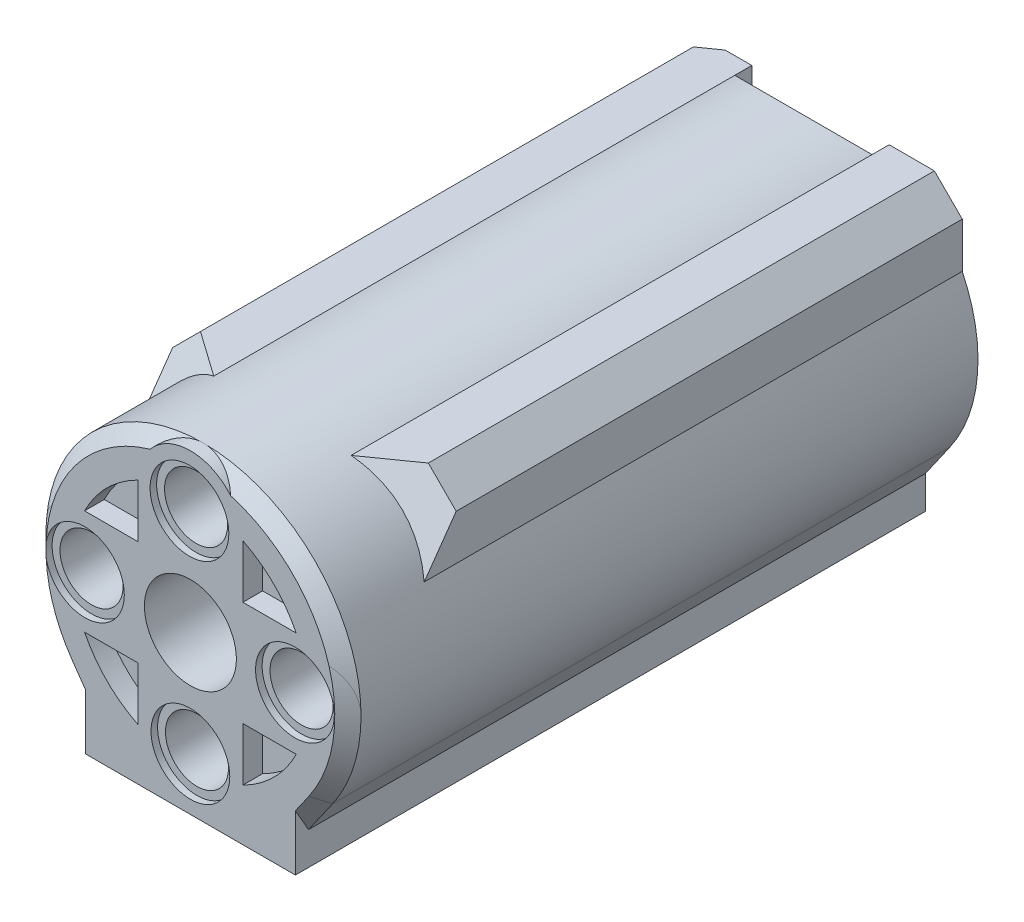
SolidWorks part; units mm, degrees
ref_plane "정면" through (0, 0, 0) normal (0, 0, 1) x (1, 0, 0)
ref_plane "윗면" through (0, 0, 0) normal (0, 1, 0) x (1, 0, 0)
ref_plane "우측면" through (0, 0, 0) normal (1, 0, 0) x (0, 0, -1)
imported_body "불러온 피처3"
sketch "스케치1" plane through (0, 0, -22.7) normal (0, 0, -1) x (-1, 0, 0)
  line L0 (10.8, 10.8) -> (10.8, 5.2307)
  line L1 (9.8345, -6.8762) -> (8, -9.5)
  line L2 (8, -9.5) -> (-8, -9.5)
  line L3 (-8, -9.5) -> (-9.8345, -6.8762)
  line L4 (-10.8, 5.2307) -> (-10.8, 10.8)
  line L5 (-10.8, 10.8) -> (10.8, 10.8)
  arc A0 (10.8, 5.2307) -> (9.8345, -6.8762) centre (0, 0) cw
  arc A1 (-9.8345, -6.8762) -> (-10.8, 5.2307) centre (0, 0) cw
extrude "보스-돌출1" add sketch "스케치1" along normal blind 1.3
ref_plane "평면1" through (-5.2307, 0, 0) normal (-1, 0, 0) x (0, -1, 0)
sketch "스케치2" plane through (-5.2307, 0, 0) normal (-1, 0, 0) x (0, -1, 0)
  line L0 (-10.8, -24) -> (-9.5, -24)
  line L1 (-9.5, -24) -> (-10.8, -22.7)
  line L2 (-10.8, -22.7) -> (-10.8, -24)
extrude "컷-돌출1" cut sketch "스케치2" against normal blind 10.4614
sketch "스케치3" plane through (0, -9.5, 0) normal (0, -1, 0) x (1, 0, 0)
  line L0 (-8, 24) -> (8, 24)
  line L1 (8, 24) -> (8, -24)
  line L2 (8, -24) -> (-8, -24)
  line L3 (-8, -24) -> (-8, 24)
extrude "보스-돌출2" add sketch "스케치3" along normal blind 2.5
sketch "스케치4" plane through (0, -12, 0) normal (0, -1, 0) x (1, 0, 0)
  line L0 (-6.3322, -22.297) -> (-1.5322, -22.297)
  line L1 (-1.5322, -22.297) -> (-1.5322, 22.503)
  line L2 (-1.5322, 22.503) -> (-6.3322, 22.503)
  line L3 (-6.3322, 22.503) -> (-6.3322, -22.297)
extrude "컷-돌출2" cut sketch "스케치4" against normal blind 1.6
sketch "스케치5" plane through (0, -12, 0) normal (0, -1, 0) x (1, 0, 0)
  line L0 (1.6678, -22.297) -> (6.4678, -22.297)
  line L1 (6.4678, -22.297) -> (6.4678, 22.503)
  line L2 (6.4678, 22.503) -> (1.6678, 22.503)
  line L3 (1.6678, 22.503) -> (1.6678, -22.297)
extrude "컷-돌출3" cut sketch "스케치5" against normal blind 1.6
hole_wizard "1/4 여유 구멍1" positions "스케치7" profile "스케치6" hole size "1/4" standard "Ansi Inch"
sketch "스케치7" plane through (0, 0, 24) normal (0, 0, 1) x (1, 0, 0)
  point P0 (0, 0)
sketch "스케치6" plane through (0, 0, 24) normal (1, 0, 0) x (0, -1, 0)
  line L0 (0, 0) -> (0, 8.5)
  line L1 (0, 8.5) -> (3.505, 8.5)
  line L2 (3.505, 8.5) -> (3.505, 0)
  line L5 (3.505, 0) -> (0, 0)
  line L10 (0, 8.5) -> (-3.505, 8.5) construction
  line L11 (0, -6.35) -> (0, 107.95) construction
  dimension "구멍 지름" = 7.01
  dimension "구멍 깊이" = 8.5
  dimension "드릴 각도" = 180
ref_plane "평면2" through (0, -10.1, 0) normal (0, -1, 0) x (1, 0, 0)
sketch "스케치8" plane through (0, -10.1, 0) normal (0, -1, 0) x (1, 0, 0)
  line L0 (-3.25, 16) -> (3.25, 16)
  line L1 (3.25, 16) -> (3.25, 17)
  line L2 (3.25, 17) -> (-3.25, 17)
  line L3 (-3.25, 17) -> (-3.25, 16)
extrude "컷-돌출4" cut sketch "스케치8" against normal up to next
sketch "스케치9" plane through (0, 0, 24) normal (0, 0, 1) x (1, 0, 0)
  line L0 (-4, 4) -> (-4, 8.0623)
  line L1 (-8.0623, 4) -> (-4, 4)
  arc A0 (-4, 8.0623) -> (-8.0623, 4) centre (0, 0) ccw
extrude "컷-돌출5" cut sketch "스케치9" against normal blind 1.5
sketch "스케치10" plane through (0, 0, 24) normal (0, 0, 1) x (1, 0, 0)
  line L0 (-4, -8.0623) -> (-4, -4)
  line L1 (-4, -4) -> (-8.0623, -4)
  arc A0 (-8.0623, -4) -> (-4, -8.0623) centre (0, 0) ccw
extrude "컷-돌출6" cut sketch "스케치10" against normal blind 1.5
sketch "스케치11" plane through (0, 0, 24) normal (0, 0, 1) x (1, 0, 0)
  line L0 (4, -4) -> (4, -8.0623)
  line L1 (8.0623, -4) -> (4, -4)
  arc A0 (4, -8.0623) -> (8.0623, -4) centre (0, 0) ccw
extrude "컷-돌출7" cut sketch "스케치11" against normal blind 1.5
sketch "스케치12" plane through (0, 0, 24) normal (0, 0, 1) x (1, 0, 0)
  line L0 (4, 8.0623) -> (4, 4)
  line L1 (4, 4) -> (8.0623, 4)
  arc A0 (8.0623, 4) -> (4, 8.0623) centre (0, 0) ccw
extrude "컷-돌출8" cut sketch "스케치12" against normal blind 1.5
ref_plane "평면3" through (0, 0, 16.103) normal (0, 0, 1) x (1, 0, 0)
sketch "스케치13" plane through (0, 0, 16.103) normal (0, 0, 1) x (1, 0, 0)
  line L0 (5.6678, -10.4) -> (4.0678, -10.4)
  line L1 (4.0678, -10.4) -> (4.0678, -12)
  line L2 (4.0678, -12) -> (5.6678, -12)
  line L3 (5.6678, -12) -> (5.6678, -10.4)
  line L4 (4.0678, -10.4) -> (4.0678, -12) construction
revolve "회전1" add sketch "스케치13" angle 360 about L4
ref_plane "평면4" through (0, 0, 8.103) normal (0, 0, 1) x (1, 0, 0)
sketch "스케치14" plane through (0, 0, 8.103) normal (0, 0, 1) x (1, 0, 0)
  line L0 (5.6678, -10.4) -> (4.0678, -10.4)
  line L1 (4.0678, -10.4) -> (4.0678, -12)
  line L2 (4.0678, -12) -> (5.6678, -12)
  line L3 (5.6678, -12) -> (5.6678, -10.4)
  line L4 (4.0678, -10.4) -> (4.0678, -12) construction
revolve "회전2" add sketch "스케치14" angle 360 about L4
ref_plane "평면5" through (0, 0, 0.103) normal (0, 0, 1) x (1, 0, 0)
sketch "스케치15" plane through (0, 0, 0.103) normal (0, 0, 1) x (1, 0, 0)
  line L0 (5.6678, -10.4) -> (4.0678, -10.4)
  line L1 (4.0678, -10.4) -> (4.0678, -12)
  line L2 (4.0678, -12) -> (5.6678, -12)
  line L3 (5.6678, -12) -> (5.6678, -10.4)
  line L4 (4.0678, -10.4) -> (4.0678, -12) construction
revolve "회전3" add sketch "스케치15" angle 360 about L4
ref_plane "평면6" through (0, 0, -7.897) normal (0, 0, 1) x (1, 0, 0)
sketch "스케치16" plane through (0, 0, -7.897) normal (0, 0, 1) x (1, 0, 0)
  line L0 (5.6678, -10.4) -> (4.0678, -10.4)
  line L1 (4.0678, -10.4) -> (4.0678, -12)
  line L2 (4.0678, -12) -> (5.6678, -12)
  line L3 (5.6678, -12) -> (5.6678, -10.4)
  line L4 (4.0678, -10.4) -> (4.0678, -12) construction
revolve "회전4" add sketch "스케치16" angle 360 about L4
ref_plane "평면7" through (0, 0, -15.897) normal (0, 0, 1) x (1, 0, 0)
sketch "스케치17" plane through (0, 0, -15.897) normal (0, 0, 1) x (1, 0, 0)
  line L0 (5.6678, -10.4) -> (4.0678, -10.4)
  line L1 (4.0678, -10.4) -> (4.0678, -12)
  line L2 (4.0678, -12) -> (5.6678, -12)
  line L3 (5.6678, -12) -> (5.6678, -10.4)
  line L4 (4.0678, -10.4) -> (4.0678, -12) construction
revolve "회전5" add sketch "스케치17" angle 360 about L4
sketch "스케치18" plane through (0, 0, 16.103) normal (0, 0, 1) x (1, 0, 0)
  line L0 (-2.3322, -10.4) -> (-3.9322, -10.4)
  line L1 (-3.9322, -10.4) -> (-3.9322, -12)
  line L2 (-3.9322, -12) -> (-2.3322, -12)
  line L3 (-2.3322, -12) -> (-2.3322, -10.4)
  line L4 (-3.9322, -10.4) -> (-3.9322, -12) construction
revolve "회전6" add sketch "스케치18" angle 360 about L4
sketch "스케치19" plane through (0, 0, 8.103) normal (0, 0, 1) x (1, 0, 0)
  line L0 (-2.3322, -10.4) -> (-3.9322, -10.4)
  line L1 (-3.9322, -10.4) -> (-3.9322, -12)
  line L2 (-3.9322, -12) -> (-2.3322, -12)
  line L3 (-2.3322, -12) -> (-2.3322, -10.4)
  line L4 (-3.9322, -10.4) -> (-3.9322, -12) construction
revolve "회전7" add sketch "스케치19" angle 360 about L4
sketch "스케치20" plane through (0, 0, 0.103) normal (0, 0, 1) x (1, 0, 0)
  line L0 (-2.3322, -10.4) -> (-3.9322, -10.4)
  line L1 (-3.9322, -10.4) -> (-3.9322, -12)
  line L2 (-3.9322, -12) -> (-2.3322, -12)
  line L3 (-2.3322, -12) -> (-2.3322, -10.4)
  line L4 (-3.9322, -10.4) -> (-3.9322, -12) construction
revolve "회전8" add sketch "스케치20" angle 360 about L4
sketch "스케치21" plane through (0, 0, -7.897) normal (0, 0, 1) x (1, 0, 0)
  line L0 (-2.3322, -10.4) -> (-3.9322, -10.4)
  line L1 (-3.9322, -10.4) -> (-3.9322, -12)
  line L2 (-3.9322, -12) -> (-2.3322, -12)
  line L3 (-2.3322, -12) -> (-2.3322, -10.4)
  line L4 (-3.9322, -10.4) -> (-3.9322, -12) construction
revolve "회전9" add sketch "스케치21" angle 360 about L4
sketch "스케치22" plane through (0, 0, -15.897) normal (0, 0, 1) x (1, 0, 0)
  line L0 (-2.3322, -10.4) -> (-3.9322, -10.4)
  line L1 (-3.9322, -10.4) -> (-3.9322, -12)
  line L2 (-3.9322, -12) -> (-2.3322, -12)
  line L3 (-2.3322, -12) -> (-2.3322, -10.4)
  line L4 (-3.9322, -10.4) -> (-3.9322, -12) construction
revolve "회전10" add sketch "스케치22" angle 360 about L4
hole_wizard "#8 바인딩 머리 작은 나사형 카운터보어1" positions "스케치24" profile "스케치23" counterbore size "#8" standard "Ansi Inch"
sketch "스케치24" plane through (0, 0, 24) normal (0, 0, 1) x (1, 0, 0)
  point P0 (0, -8)
sketch "스케치23" plane through (0, -8, 24) normal (1, 0, 0) x (0, -1, 0)
  line L0 (0, 0) -> (0, 8.5)
  line L1 (0, 8.5) -> (2.4, 8.5)
  line L2 (2.4, 8.5) -> (2.4, 0.5)
  line L3 (2.4, 0.5) -> (3, 0.5)
  line L4 (3, 0.5) -> (3, 0)
  line L5 (3, 0) -> (0, 0)
  line L10 (0, 8.5) -> (-2.4, 8.5) construction
  line L11 (0, -6.35) -> (0, 107.95) construction
  dimension "구멍 지름" = 4.8
  dimension "구멍 깊이" = 8.5
  dimension "카운터보어 지름" = 6
  dimension "카운터보어 깊이" = 0.5
  dimension "드릴 각도" = 180
hole_wizard "#8 바인딩 머리 작은 나사형 카운터보어2" positions "스케치26" profile "스케치25" counterbore size "#8" standard "Ansi Inch"
sketch "스케치26" plane through (0, 0, 24) normal (0, 0, 1) x (1, 0, 0)
  point P0 (-0.07, 8)
sketch "스케치25" plane through (-0.07, 8, 24) normal (1, 0, 0) x (0, -1, 0)
  line L0 (0, 0) -> (0, 8.5)
  line L1 (0, 8.5) -> (2.4, 8.5)
  line L2 (2.4, 8.5) -> (2.4, 0.5)
  line L3 (2.4, 0.5) -> (3, 0.5)
  line L4 (3, 0.5) -> (3, 0)
  line L5 (3, 0) -> (0, 0)
  line L10 (0, 8.5) -> (-2.4, 8.5) construction
  line L11 (0, -6.35) -> (0, 107.95) construction
  dimension "구멍 지름" = 4.8
  dimension "구멍 깊이" = 8.5
  dimension "카운터보어 지름" = 6
  dimension "카운터보어 깊이" = 0.5
  dimension "드릴 각도" = 180
hole_wizard "#8 바인딩 머리 작은 나사형 카운터보어3" positions "스케치28" profile "스케치27" counterbore size "#8" standard "Ansi Inch"
sketch "스케치28" plane through (0, 0, 24) normal (0, 0, 1) x (1, 0, 0)
  point P0 (7.965, 0.035)
  point P1 (-8.035, -0.035)
sketch "스케치27" plane through (7.965, 0.035, 24) normal (1, 0, 0) x (0, -1, 0)
  line L0 (0, 0) -> (0, 8.5)
  line L1 (0, 8.5) -> (2.4, 8.5)
  line L2 (2.4, 8.5) -> (2.4, 0.5)
  line L3 (2.4, 0.5) -> (3, 0.5)
  line L4 (3, 0.5) -> (3, 0)
  line L5 (3, 0) -> (0, 0)
  line L10 (0, 8.5) -> (-2.4, 8.5) construction
  line L11 (0, -6.35) -> (0, 107.95) construction
  dimension "구멍 지름" = 4.8
  dimension "구멍 깊이" = 8.5
  dimension "카운터보어 지름" = 6
  dimension "카운터보어 깊이" = 0.5
  dimension "드릴 각도" = 180
chamfer "모따기1" distance 2.1213 angle 45 3 edges at (-10.8, 10.8, -5.474) (10.8, 10.8, -5.474)
chamfer "모따기2" distance 1 angle 45 13 edges at (11.4458, -3.6045, 24) (-11.4458, -3.6045, 24) (-12, 0, 23.5) (12, 0, 23.5) (11.6228, 1.6956, 24) (-11.6228, 1.6956, 24) (-8.9173, -8.1881, -24) (-11.962, -0.9539, -24) (-9.7393, 9.7393, -24)
